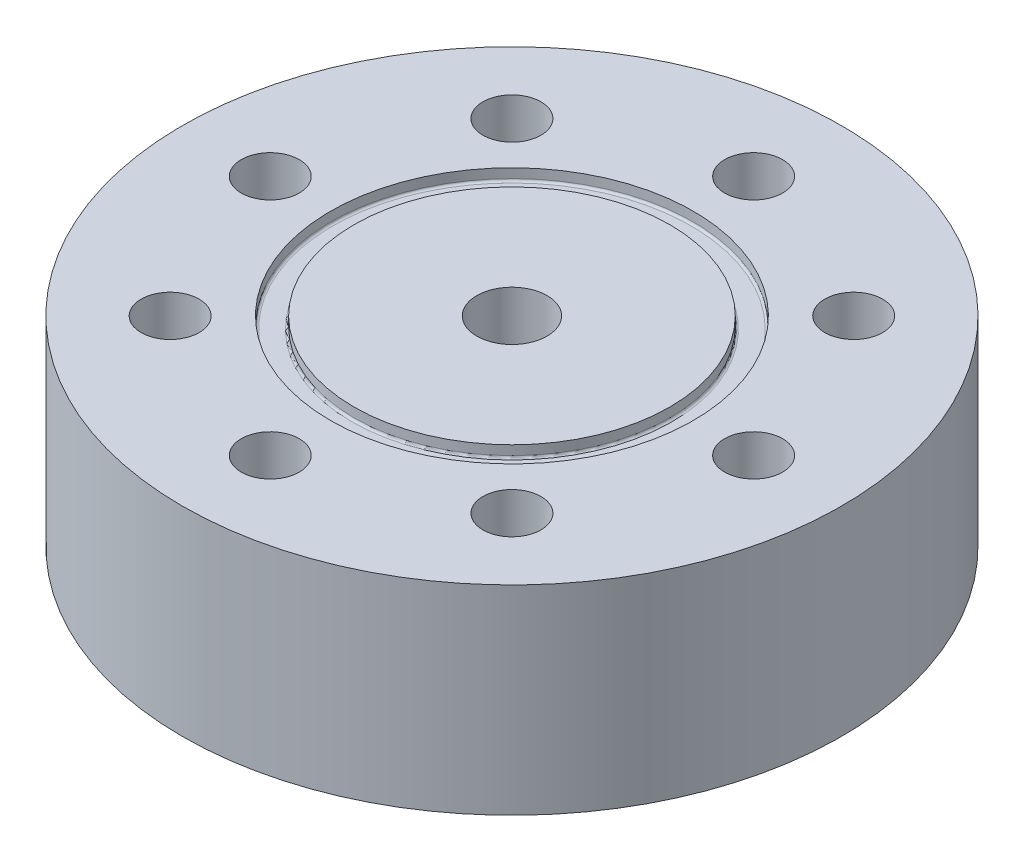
SolidWorks part; units mm, degrees
ref_plane "Front Plane" through (0, 0, 0) normal (0, 0, 1) x (1, 0, 0)
ref_plane "Top Plane" through (0, 0, 0) normal (0, 1, 0) x (1, 0, 0)
ref_plane "Right Plane" through (0, 0, 0) normal (1, 0, 0) x (0, 0, -1)
sketch "Sketch2" plane through (0, 0, 0) normal (0, 1, 0) x (1, 0, 0)
  circle A0 centre (0, 0) radius 37.5
  dimension "D1" = 75
extrude "Outer Cylinder" add sketch "Sketch2" along normal blind 22.7
sketch "Sketch3" plane through (0, 0, 0) normal (0, -1, 0) x (1, 0, 0)
  circle A0 centre (0, 0) radius 8.93
  dimension "D1" = 17.86
extrude "NPT Hole" cut sketch "Sketch3" against normal blind 12.7
sketch "Sketch4" plane through (0, 0, 0) normal (0, -1, 0) x (1, 0, 0)
  circle A0 centre (-27.5, 0) radius 3.3
  circle A1 centre (-19.4454, 19.4454) radius 3.3
  circle A2 centre (0, 27.5) radius 3.3
  circle A3 centre (19.4454, 19.4454) radius 3.3
  circle A4 centre (27.5, 0) radius 3.3
  circle A5 centre (19.4454, -19.4454) radius 3.3
  circle A6 centre (0, -27.5) radius 3.3
  circle A7 centre (-19.4454, -19.4454) radius 3.3
  point P19 (0, 0)
  dimension "D1" = 6.6
  dimension "D2" = 27.5
  dimension "D3" = 8
extrude "Bolt Holes" cut sketch "Sketch4" against normal through all
sketch "Sketch5" plane through (0, 22.7, 0) normal (0, 1, 0) x (1, 0, 0)
  circle A0 centre (0, 0) radius 17.9705
  circle A1 centre (0, 0) radius 20.6375
  dimension "D1" = 41.275
  dimension "D2" = 2.667
extrude "O-Ring Groove" cut sketch "Sketch5" against normal blind 1.3208
fillet "Fillet1" radius 0.254 2 edges at (0, 21.3792, 17.9705) (0, 21.3792, 20.6375)
sketch "Sketch6" plane through (0, 22.7, 0) normal (0, 1, 0) x (1, 0, 0)
  circle A0 centre (0, 0) radius 4
extrude "Inlet Flow Diameter" cut sketch "Sketch6" against normal blind 10
equation "\"D\"= 8"
equation "\"Inlet Flow Diameter\"= \"D\""
equation "\"D1@Sketch6\"=\"D\""
